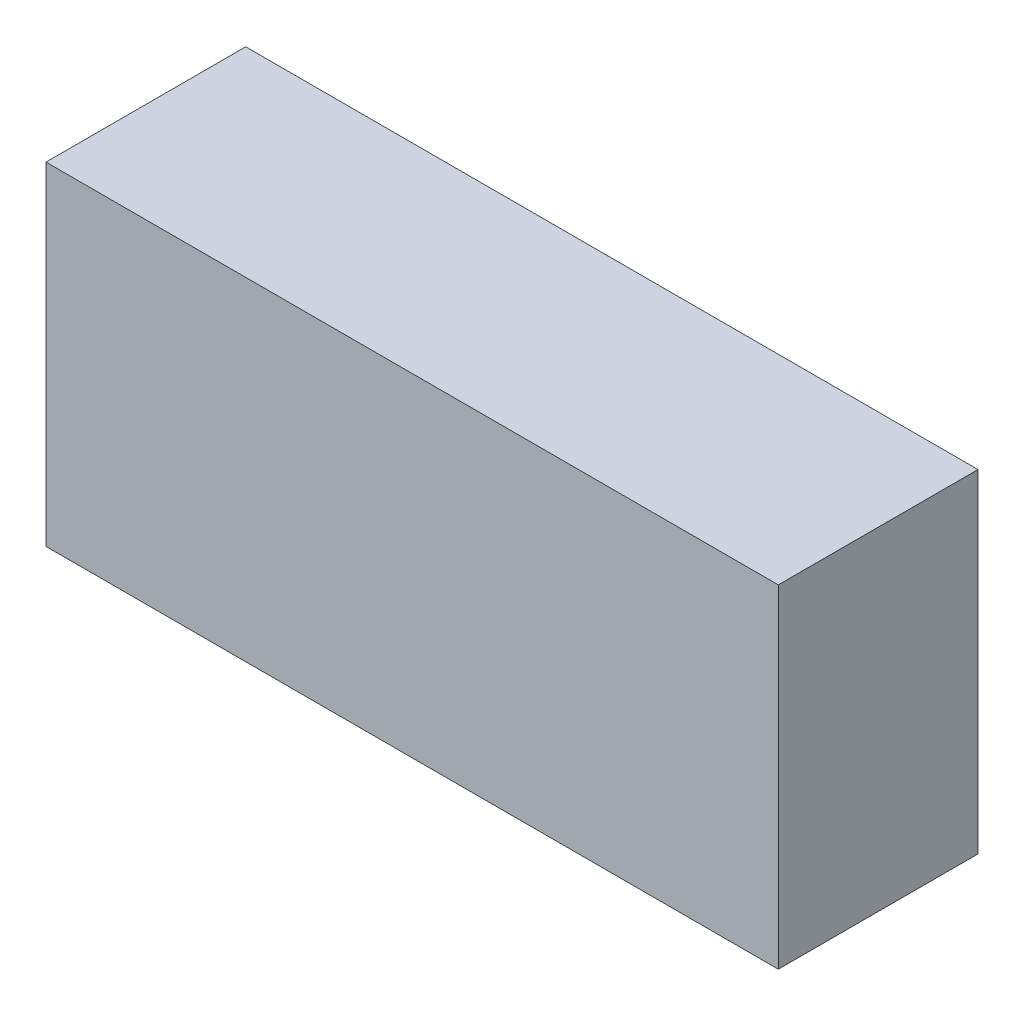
SolidWorks part; units mm, degrees
ref_plane "Front Plane" through (0, 0, 0) normal (0, 0, 1) x (1, 0, 0)
ref_plane "Top Plane" through (0, 0, 0) normal (0, 1, 0) x (1, 0, 0)
ref_plane "Right Plane" through (0, 0, 0) normal (1, 0, 0) x (0, 0, -1)
sketch "Sketch2" plane through (0, 0, 0) normal (0, 1, 0) x (1, 0, 0)
  line L1 (-69.85, 19.05) -> (69.85, 19.05)
  line L2 (-69.85, 19.05) -> (-69.85, -19.05)
  line L3 (-69.85, -19.05) -> (69.85, -19.05)
  line L4 (69.85, 19.05) -> (69.85, -19.05)
  line L5 (-69.85, 19.05) -> (69.85, -19.05) construction
  line L6 (-69.85, -19.05) -> (69.85, 19.05) construction
  point P0 (0, 0)
  dimension "D1" = 139.7
  dimension "D2" = 38.1
extrude "Boss-Extrude1" add sketch "Sketch2" along normal blind 63.5
